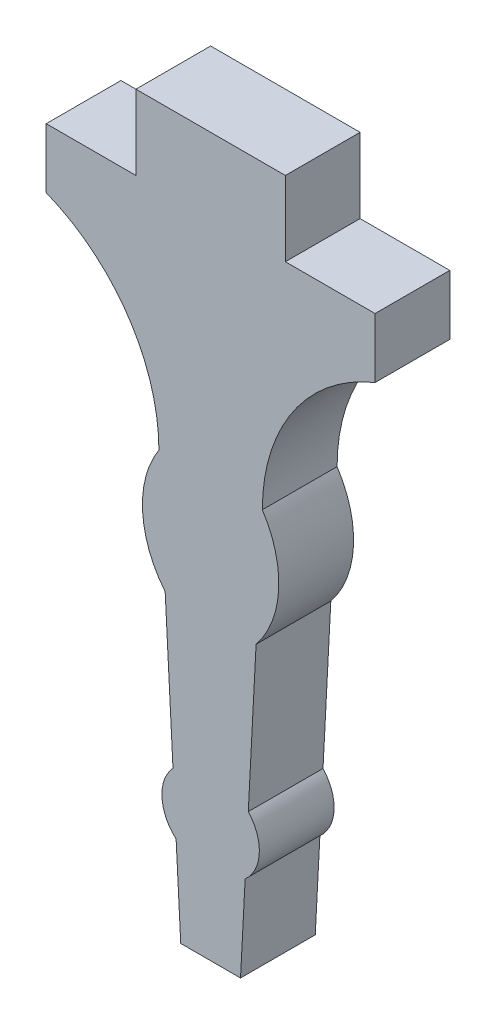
SolidWorks part; units mm, degrees
ref_plane "Front Plane" through (0, 0, 0) normal (0, 0, 1) x (1, 0, 0)
ref_plane "Top Plane" through (0, 0, 0) normal (0, 1, 0) x (1, 0, 0)
ref_plane "Right Plane" through (0, 0, 0) normal (1, 0, 0) x (0, 0, -1)
sketch "Sketch1" plane through (0, 0, 0) normal (0, 0, 1) x (1, 0, 0)
  line L0 (0, 0) -> (0, -4.7326) construction
  line L5 (3.175, 0) -> (-3.175, 0)
  line L6 (-3.175, 0) -> (-3.175, -3.175)
  line L7 (-3.175, -3.175) -> (-6.985, -3.175)
  line L8 (-6.985, -3.175) -> (-6.985, -5.715)
  line L9 (-1.9309, -17.8691) -> (-1.5994, -24.195)
  line L10 (-1.4663, -26.735) -> (-1.27, -30.48)
  line L11 (-1.27, -30.48) -> (1.27, -30.48)
  line L12 (-2.1971, -12.7891) -> (-1.9309, -17.8691) construction
  line L13 (2.1971, -12.7891) -> (1.9309, -17.8691) construction
  line L14 (1.4663, -26.735) -> (1.27, -30.48)
  line L15 (1.9309, -17.8691) -> (1.5994, -24.195)
  line L16 (6.985, -3.175) -> (6.985, -5.715)
  line L17 (3.175, -3.175) -> (6.985, -3.175)
  line L18 (3.175, 0) -> (3.175, -3.175)
  arc A0 (-6.985, -5.715) -> (-2.1971, -12.7891) centre (-9.8171, -12.7891) cw
  arc A1 (-2.1971, -12.7891) -> (-1.9309, -17.8691) centre (1.4206, -15.1465) ccw
  arc A2 (-1.4663, -26.735) -> (-1.5994, -24.195) centre (-0.292, -25.4) cw
  arc A3 (1.4663, -26.735) -> (1.5994, -24.195) centre (0.292, -25.4) ccw
  arc A4 (2.1971, -12.7891) -> (1.9309, -17.8691) centre (-1.4206, -15.1465) cw
  arc A5 (6.985, -5.715) -> (2.1971, -12.7891) centre (9.8171, -12.7891) ccw
  point P13 (-1.5939, -16.3531)
  point P26 (0, -30.48)
  dimension "D3" = 1.778
  dimension "D12" = 4.318
  dimension "D13" = 7.62
  dimension "D1" = 3.175
  dimension "D2" = 3.175
  dimension "D4" = 2.54
  dimension "D5" = 30.48
  dimension "D6" = 1.27
  dimension "D7" = 3.81
  dimension "D8" = 93
  dimension "D9" = 2.54
  dimension "D10" = 5.08
  dimension "D11" = 5.08
extrude "Boss-Extrude1" add sketch "Sketch1" along normal blind 3.175
